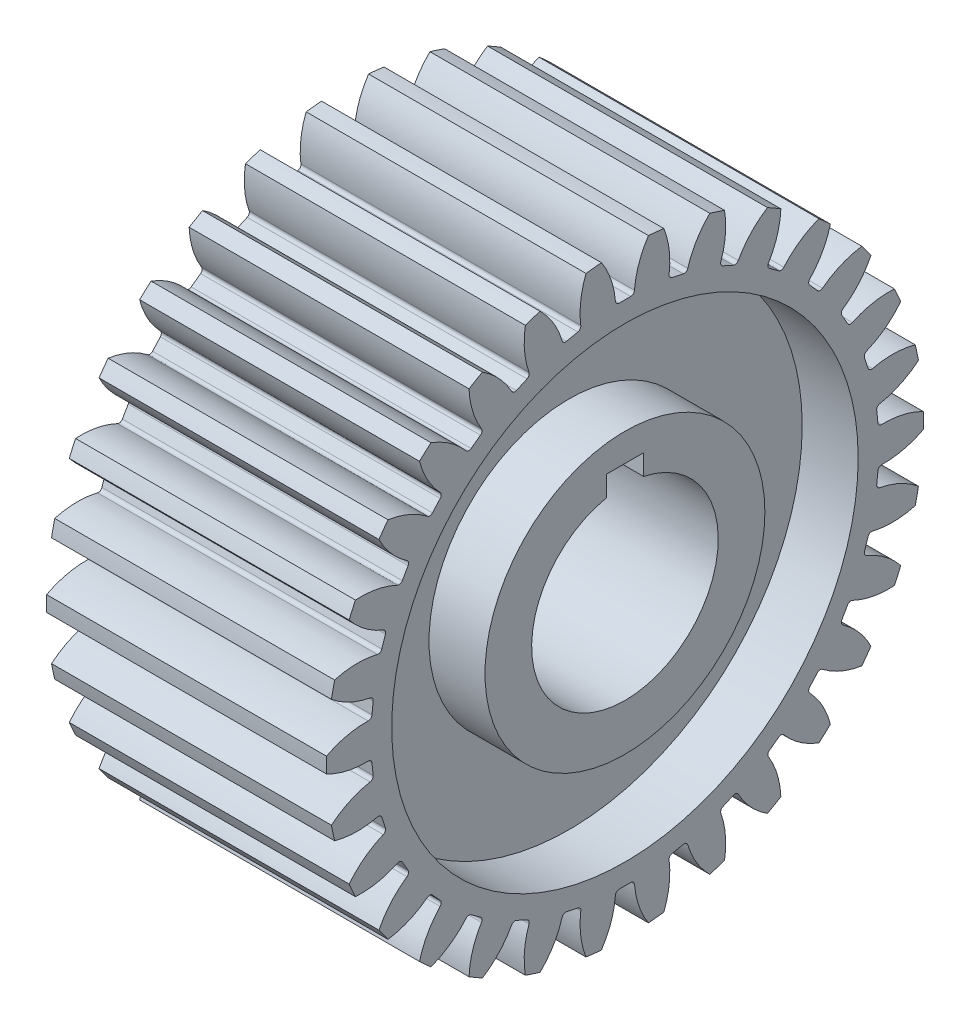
SolidWorks part; units mm, degrees
ref_plane "Front Plane" through (0, 0, 0) normal (0, 0, 1) x (1, 0, 0)
ref_plane "Top Plane" through (0, 0, 0) normal (0, 1, 0) x (1, 0, 0)
ref_plane "Right Plane" through (0, 0, 0) normal (1, 0, 0) x (0, 0, -1)
sketch "Sketch1" plane through (0, 0, 0) normal (1, 0, 0) x (0, 0, -1)
  circle A0 centre (0, 0) radius 16
  dimension "D1" = 32
extrude "circular - extrude" add sketch "Sketch1" along normal mid plane 15
sketch "Sketch3" plane through (7.5, 0, 0) normal (1, 0, 0) x (0, 0, -1)
  line L2 (-1, 4.899) -> (-1, 6)
  line L3 (-1, 6) -> (1, 6)
  line L4 (1, 4.899) -> (1, 6)
  arc A0 (-1, 4.899) -> (1, 4.899) centre (0, 0) ccw
  point P1 (0, 6)
  point P3 (0, 5)
  dimension "D1" = 10
  dimension "D2" = 2
  dimension "D3" = 1
  dimension "D4" = 1
extrude "Cut- circular + top rectangle" cut sketch "Sketch3" against normal through all
sketch "Sketch4" plane through (7.5, 0, 0) normal (1, 0, 0) x (0, 0, -1)
  circle A0 centre (0, 0) radius 7.5
  circle A1 centre (0, 0) radius 12.5
  dimension "D1" = 25
  dimension "D2" = 15
extrude "extrude cut ( rad: 25 -15)" cut sketch "Sketch4" against normal blind 3
mirror "mirror - extrude cut" about plane through (0, 0, 0) normal (1, 0, 0) of "extrude cut ( rad: 25 -15)"
sketch "Sketch5" plane through (7.5, 0, 0) normal (1, 0, 0) x (0, 0, -1)
  line L0 (0, 0) -> (0, 16) construction
  line L1 (0, 16) -> (0, 18.1227) construction
  line L2 (-0.3114, 13.6) -> (0.3114, 13.6)
  line L3 (0.5, 13.6) -> (0.5, 12.49)
  circle A0 centre (0, 0) radius 16 construction
  circle A1 centre (0, 0) radius 12.5 construction
  arc A2 (0.5108, 13.7843) -> (2.08, 16.88) centre (5.0567, 13.4256) cw
  arc A3 (-0.5108, 13.7843) -> (-2.08, 16.88) centre (-5.0567, 13.4256) ccw
  arc A4 (-2.08, 16.88) -> (2.08, 16.88) centre (0, 10.8511) cw
  arc A5 (-0.5108, 13.7843) -> (-0.3114, 13.6) centre (-0.3114, 13.8) ccw
  arc A6 (0.5108, 13.7843) -> (0.3114, 13.6) centre (0.3114, 13.8) cw
  point P14 (0.9894, 15.4873)
  point P16 (0, 13.6)
  point P21 (-0.5, 13.6)
  dimension "D3" = 1.58
  dimension "D6" = 0.2
  dimension "D7" = 6.3777
  dimension "D1" = 0.5
  dimension "D2" = 13.6
  dimension "D4" = 3.28
  dimension "D5" = 4.56
extrude "Cut - tooth" cut sketch "Sketch5" against normal through all contours A6 A2 A3 A5 L2 M5
pattern_circular "30 nos" count 30 over 360 about axis through (0, 0, 0) along (1, 0, 0) of "Cut - tooth"
